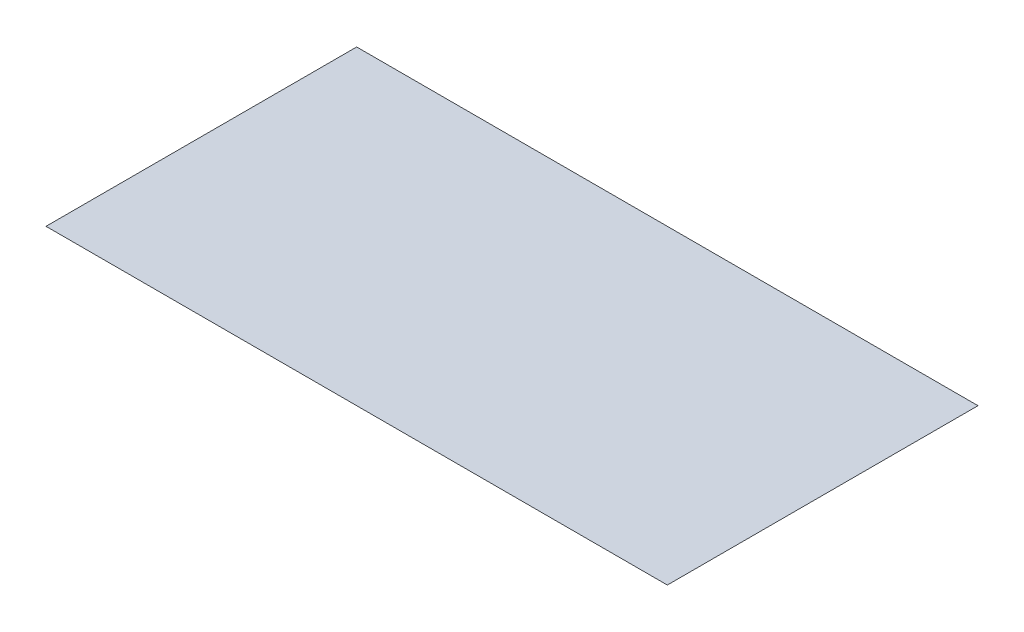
SolidWorks part; units mm, degrees
ref_plane "Front Plane" through (0, 0, 0) normal (0, 0, 1) x (1, 0, 0)
ref_plane "Top Plane" through (0, 0, 0) normal (0, 1, 0) x (1, 0, 0)
ref_plane "Right Plane" through (0, 0, 0) normal (1, 0, 0) x (0, 0, -1)
sketch "Sketch1" plane through (0, 0, 0) normal (0, 1, 0) x (1, 0, 0)
  line L1 (-150, 75) -> (150, 75)
  line L2 (-150, 75) -> (-150, -75)
  line L3 (-150, -75) -> (150, -75)
  line L4 (150, 75) -> (150, -75)
  line L5 (-150, 75) -> (150, -75) construction
  line L6 (-150, -75) -> (150, 75) construction
  point P0 (0, 0)
  dimension "D1" = 300
  dimension "D2" = 150
surface "Surface-Plane1" sketch "Sketch1"
sketch "Sketch2" plane through (0, 0, 0) normal (0, 0, 1) x (1, 0, 0)
  spline S0 degree 3 poles (-150, 0) (-151.998, 49.7645) (-82.2033, 92.4653) (-5.5811, 46.4013) (67.3064, 26.0523) (147.5465, 46.0818) (150, 0) knots 0 0 0 0 0.342969 0.493904 0.710526 1 1 1 1
ref_plane "Plane1" through (-12.4728, 0, 0) normal (1, 0, 0) x (0, 0, -1)
sketch "Sketch5" plane through (-12.4728, 0, 0) normal (1, 0, 0) x (0, 0, -1)
  arc A0 (-75, 0) -> (75, 0) centre (0, -26.9297) cw
